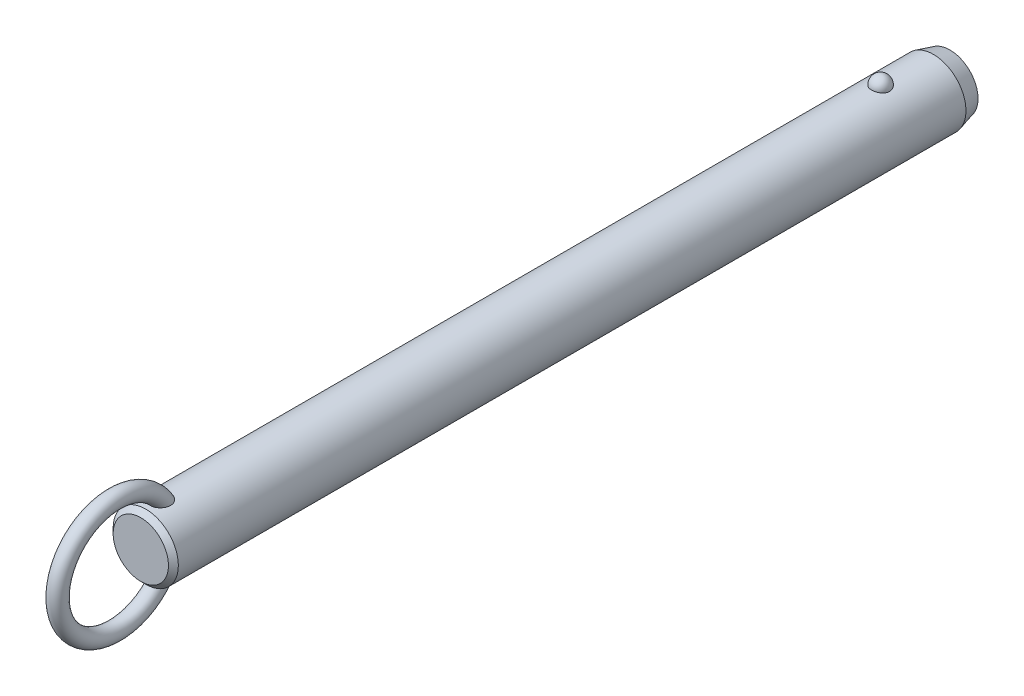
SolidWorks part; units mm, degrees
ref_plane "Front Plane" through (0, 0, 0) normal (0, 0, 1) x (1, 0, 0)
ref_plane "Top Plane" through (0, 0, 0) normal (0, 1, 0) x (1, 0, 0)
ref_plane "Right Plane" through (0, 0, 0) normal (1, 0, 0) x (0, 0, -1)
sketch "Sketch2" plane through (0, 0, 0) normal (0, 0, 1) x (1, 0, 0)
  circle A0 centre (0, 0) radius 7.9
  point P3 (0, 7.9)
  dimension "D1" = 15.8
extrude "Boss-Extrude1" add sketch "Sketch2" along normal blind 167.6
sketch "Sketch3" plane through (0, 0, 0) normal (0, 0, -1) x (-1, 0, 0)
  circle A0 centre (0, 0) radius 7.9
  dimension "D1" = 15.8
extrude "Boss-Extrude2" add sketch "Sketch3" along normal blind 19
chamfer "Chamfer1" distance 4 angle 15 1 edges at (-7.9, 0, -19)
sketch "Sketch12" plane through (0, 0, 0) normal (1, 0, 0) x (0, 0, -1)
  line L0 (-167.6, 7.9) -> (-167.6, -7.9) construction
  point P0 (-167.6, 0)
sketch "Sketch13" plane through (0, 0, 0) normal (1, 0, 0) x (0, 0, -1)
  circle A0 centre (-183.45, 0) radius 15.85
  point P2 (-167.6, 0)
  dimension "D1" = 31.7
sketch "Sketch14" plane through (0, 0, 0) normal (0, 1, 0) x (1, 0, 0)
  circle A0 centre (0, -169.6) radius 2
  point P2 (0, -167.6)
  dimension "D1" = 4
sweep "Sweep1" add profiles "Sketch14" path "Sketch13"
sketch "Sketch15" plane through (0, 0, 167.6) normal (0, 0, 1) x (1, 0, 0)
  circle A0 centre (0, 0) radius 7.9
  dimension "D1" = 15.8
extrude "Boss-Extrude3" add sketch "Sketch15" along normal blind 9.52
chamfer "Chamfer2" distance 1.2 angle 45 1 edges at (7.9, 0, 177.12)
sketch "Sketch18" plane through (0, 0, 0) normal (1, 0, 0) x (0, 0, -1)
  line L0 (15, 7.9) -> (-169.7091, 7.9) construction
  line L1 (2.2, 10.1) -> (2.2, 5.7)
  line L2 (-169.7091, -7.9) -> (15, -7.9) construction
  arc A0 (2.2, 10.1) -> (2.2, 5.7) centre (2.2, 7.9) ccw
  point P4 (0, 7.9)
  dimension "D1" = 18
revolve "Revolve1" add sketch "Sketch18" angle 360 about L1
